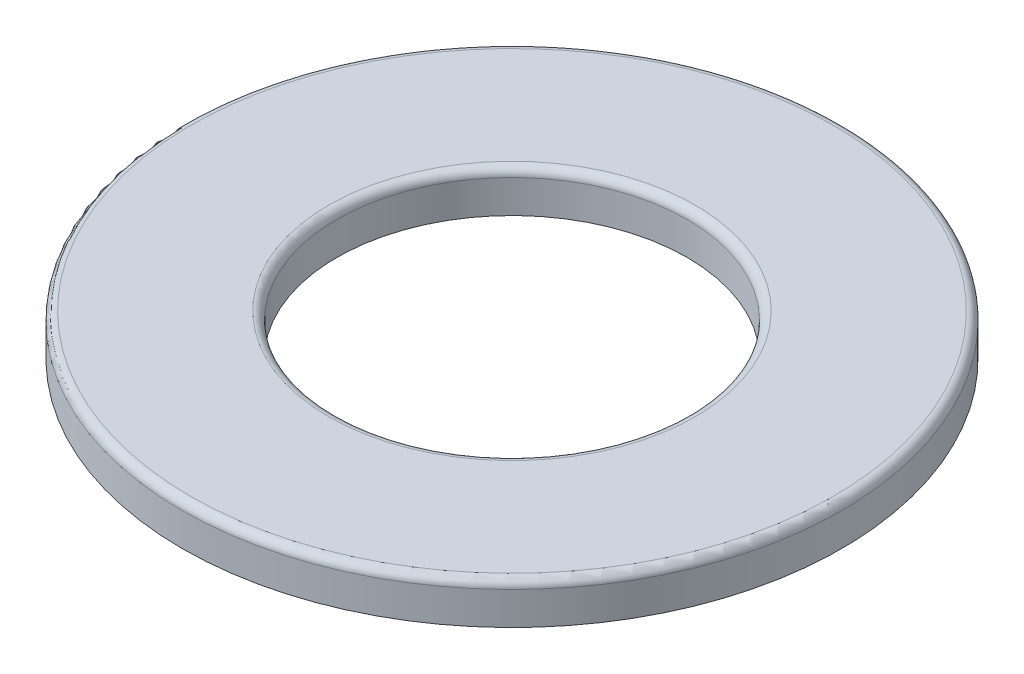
SolidWorks part; units mm, degrees
ref_plane "前视基准面" through (0, 0, 0) normal (0, 0, 1) x (1, 0, 0)
ref_plane "上视基准面" through (0, 0, 0) normal (0, 1, 0) x (1, 0, 0)
ref_plane "右视基准面" through (0, 0, 0) normal (1, 0, 0) x (0, 0, -1)
sketch "草图1" plane through (0, 0, 0) normal (0, 1, 0) x (1, 0, 0)
  circle A0 centre (0, 0) radius 8
  circle A1 centre (0, 0) radius 4.25
  dimension "D1" = 8.5
  dimension "D2" = 16
extrude "凸台-拉伸1" add sketch "草图1" along normal mid plane 1
fillet "圆角1" radius 0.2 2 edges at (0, 0.5, 8) (0, 0.5, 4.25)
